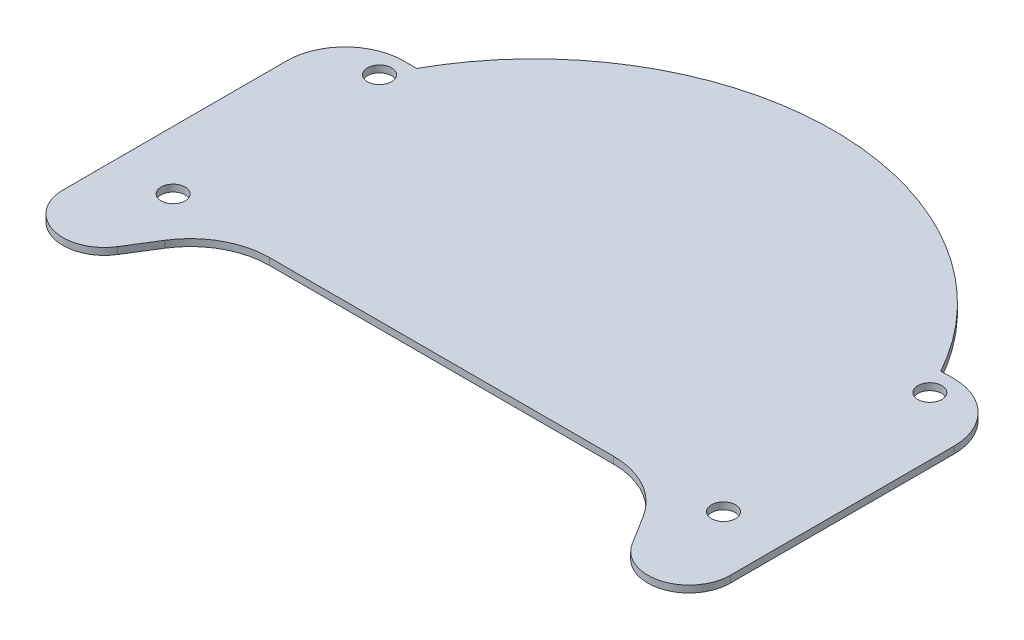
SolidWorks part; units mm, degrees
ref_plane "Alzado" through (0, 0, 0) normal (0, 0, 1) x (1, 0, 0)
ref_plane "Planta" through (0, 0, 0) normal (0, 1, 0) x (1, 0, 0)
ref_plane "Vista lateral" through (0, 0, 0) normal (1, 0, 0) x (0, 0, -1)
sketch "Croquis1" plane through (0, 0, 0) normal (0, 1, 0) x (1, 0, 0)
  line L6 (0, -7.8694) -> (0, 23.217) construction
  line L7 (50, 0) -> (-50, 0)
  line L8 (-66.9811, -9.434) -> (-72.2642, -17.9245)
  line L9 (80, 75) -> (77.9423, 75)
  line L10 (-100, -10) -> (-100, 55)
  line L11 (-80, 75) -> (-77.9423, 75)
  line L12 (100, -10) -> (100, 55)
  line L13 (66.9811, -9.434) -> (72.2642, -17.9245)
  arc A0 (-77.9423, 75) -> (77.9423, 75) centre (0, 30) cw
  arc A1 (-50, 0) -> (-66.9811, -9.434) centre (-50, -20) ccw
  arc A2 (-100, 55) -> (-80, 75) centre (-80, 55) cw
  arc A3 (-72.2642, -17.9245) -> (-100, -10) centre (-85, -10) cw
  arc A4 (72.2642, -17.9245) -> (100, -10) centre (85, -10) ccw
  arc A5 (100, 55) -> (80, 75) centre (80, 55) ccw
  arc A6 (50, 0) -> (66.9811, -9.434) centre (50, -20) cw
  circle A7 centre (-80, 65) radius 2.5
  circle A8 centre (-80, 5) radius 2.5
  circle A9 centre (80, 5) radius 2.5
  circle A10 centre (80, 65) radius 2.5
  point P0 (100, 75)
  point P11 (0, 0)
  point P15 (-100, 75)
sketch "Croquis2" plane through (0, 0, 0) normal (0, 1, 0) x (1, 0, 0)
  line L0 (66.9811, -9.434) -> (72.2642, -17.9245) construction
  line L1 (100, -10) -> (100, 55) construction
  line L2 (80, 75) -> (77.9423, 75) construction
  line L3 (50, 0) -> (-50, 0) construction
  line L4 (-66.9811, -9.434) -> (-72.2642, -17.9245) construction
  line L5 (-100, -10) -> (-100, 55) construction
  line L6 (-80, 75) -> (-77.9423, 75) construction
  line L7 (66.9811, -9.434) -> (72.2642, -17.9245)
  line L8 (100, -10) -> (100, 55)
  line L9 (80, 75) -> (77.9423, 75)
  line L10 (50, 0) -> (-50, 0)
  line L11 (-66.9811, -9.434) -> (-72.2642, -17.9245)
  line L12 (-100, -10) -> (-100, 55)
  line L13 (-80, 75) -> (-77.9423, 75)
  line L14 (0, -200007.8694) -> (0, 200023.217) construction
  line L15 (-48.6068, 49.4273) -> (-27.6068, 49.4273)
  line L16 (-48.6068, 49.4273) -> (-48.6068, 65.4273)
  line L17 (-48.6068, 65.4273) -> (-27.6068, 65.4273)
  line L18 (-27.6068, 49.4273) -> (-27.6068, 65.4273)
  line L19 (-48.6068, 49.4273) -> (-27.6068, 65.4273) construction
  line L20 (-48.6068, 65.4273) -> (-27.6068, 49.4273) construction
  line L21 (0, -200007.8694) -> (0, 200023.217) construction
  line L22 (-28, 105.9273) -> (28, 105.9273)
  line L23 (-28, 105.9273) -> (-28, 70.9273)
  line L24 (-28, 70.9273) -> (28, 70.9273)
  line L25 (28, 105.9273) -> (28, 70.9273)
  line L26 (-28, 105.9273) -> (28, 70.9273) construction
  line L27 (-28, 70.9273) -> (28, 105.9273) construction
  line L28 (0, 0) -> (0, 120) construction
  line L30 (-80.2642, 30.8767) -> (-64.2642, 30.8767)
  line L31 (-80.2642, 30.8767) -> (-80.2642, 48.8767)
  line L32 (-80.2642, 48.8767) -> (-64.2642, 48.8767)
  line L33 (-64.2642, 30.8767) -> (-64.2642, 48.8767)
  line L34 (-80.2642, 30.8767) -> (-64.2642, 48.8767) construction
  line L35 (-80.2642, 48.8767) -> (-64.2642, 30.8767) construction
  line L36 (-85.2642, 35.3767) -> (-80.2642, 35.3767)
  line L37 (-85.2642, 35.3767) -> (-85.2642, 44.3767)
  line L38 (-85.2642, 44.3767) -> (-80.2642, 44.3767)
  line L39 (-80.2642, 35.3767) -> (-80.2642, 44.3767)
  line L40 (-85.2642, 35.3767) -> (-80.2642, 44.3767) construction
  line L41 (-85.2642, 44.3767) -> (-80.2642, 35.3767) construction
  line L42 (-14.5, 57.4273) -> (14.5, 57.4273)
  line L43 (-14.5, 57.4273) -> (-14.5, 1.4273)
  line L44 (-14.5, 1.4273) -> (14.5, 1.4273)
  line L45 (14.5, 57.4273) -> (14.5, 1.4273)
  line L46 (-14.5, 57.4273) -> (14.5, 1.4273) construction
  line L47 (-14.5, 1.4273) -> (14.5, 57.4273) construction
  line L48 (57.5127, 31.7346) -> (69.5127, 31.7346)
  line L49 (57.5127, 31.7346) -> (57.5127, 19.7346)
  line L50 (57.5127, 19.7346) -> (69.5127, 19.7346)
  line L51 (69.5127, 31.7346) -> (69.5127, 19.7346)
  line L52 (57.5127, 31.7346) -> (69.5127, 19.7346) construction
  line L53 (57.5127, 19.7346) -> (69.5127, 31.7346) construction
  line L57 (43.3706, 45.8767) -> (43.3706, 33.8767)
  line L58 (43.3706, 45.8767) -> (55.3706, 45.8767)
  line L59 (55.3706, 45.8767) -> (55.3706, 33.8767)
  line L60 (43.3706, 33.8767) -> (55.3706, 33.8767)
  line L61 (57.5127, 60.0188) -> (57.5127, 48.0188)
  line L62 (57.5127, 60.0188) -> (69.5127, 60.0188)
  line L63 (69.5127, 60.0188) -> (69.5127, 48.0188)
  line L64 (57.5127, 48.0188) -> (69.5127, 48.0188)
  line L65 (71.6548, 45.8767) -> (71.6548, 33.8767)
  line L66 (71.6548, 45.8767) -> (83.6548, 45.8767)
  line L67 (83.6548, 45.8767) -> (83.6548, 33.8767)
  line L68 (71.6548, 33.8767) -> (83.6548, 33.8767)
  line L70 (-64.46, 18.7513) -> (-56.46, 18.7513)
  line L71 (-64.46, 18.7513) -> (-64.46, 10.7513)
  line L72 (-64.46, 10.7513) -> (-56.46, 10.7513)
  line L73 (-56.46, 18.7513) -> (-56.46, 10.7513)
  line L74 (-64.46, 18.7513) -> (-56.46, 10.7513) construction
  line L75 (-64.46, 10.7513) -> (-56.46, 18.7513) construction
  line L80 (-9, 64.4273) -> (9, 64.4273)
  line L81 (-9, 64.4273) -> (-9, 57.4273)
  line L82 (-98.9874, 0.7513) -> (-81.9874, 0.7513)
  line L83 (-98.9874, 0.7513) -> (-98.9874, -12.2487)
  line L84 (-98.9874, -12.2487) -> (-81.9874, -12.2487)
  line L85 (-81.9874, 0.7513) -> (-81.9874, -12.2487)
  line L86 (-98.9874, 0.7513) -> (-81.9874, -12.2487) construction
  line L87 (-98.9874, -12.2487) -> (-81.9874, 0.7513) construction
  line L88 (-92.9874, -10.2487) -> (-99.9874, -10.2487)
  line L89 (-92.9874, -10.2487) -> (-92.9874, -1.2487)
  line L90 (-92.9874, -1.2487) -> (-99.9874, -1.2487)
  line L91 (-99.9874, -10.2487) -> (-99.9874, -1.2487)
  line L92 (-92.9874, -10.2487) -> (-99.9874, -1.2487) construction
  line L93 (-92.9874, -1.2487) -> (-99.9874, -10.2487) construction
  line L94 (-9, 57.4273) -> (9, 57.4273)
  line L95 (9, 64.4273) -> (9, 57.4273)
  line L96 (-9, 64.4273) -> (9, 57.4273) construction
  line L97 (-9, 57.4273) -> (9, 64.4273) construction
  line L98 (27.8448, 19.3621) -> (38.0048, 19.3621)
  line L99 (27.8448, 19.3621) -> (27.8448, 6.6621)
  line L100 (27.8448, 6.6621) -> (38.0048, 6.6621)
  line L101 (38.0048, 19.3621) -> (38.0048, 6.6621)
  line L102 (27.8448, 19.3621) -> (38.0048, 6.6621) construction
  line L103 (27.8448, 6.6621) -> (38.0048, 19.3621) construction
  arc A0 (72.2642, -17.9245) -> (100, -10) centre (85, -10) ccw construction
  arc A1 (100, 55) -> (80, 75) centre (80, 55) ccw construction
  arc A2 (77.9423, 75) -> (-77.9423, 75) centre (0, 30) ccw construction
  arc A3 (-50, 0) -> (-66.9811, -9.434) centre (-50, -20) ccw construction
  arc A4 (-100, -10) -> (-72.2642, -17.9245) centre (-85, -10) ccw construction
  arc A5 (-80, 75) -> (-100, 55) centre (-80, 55) ccw construction
  arc A6 (72.2642, -17.9245) -> (100, -10) centre (85, -10) ccw
  arc A7 (100, 55) -> (80, 75) centre (80, 55) ccw
  arc A8 (77.9423, 75) -> (-77.9423, 75) centre (0, 30) ccw
  arc A9 (-50, 0) -> (-66.9811, -9.434) centre (-50, -20) ccw
  arc A10 (-100, -10) -> (-72.2642, -17.9245) centre (-85, -10) ccw
  arc A11 (-80, 75) -> (-100, 55) centre (-80, 55) ccw
  arc A12 (66.9811, -9.434) -> (50, 0) centre (50, -20) ccw construction
  arc A13 (66.9811, -9.434) -> (50, 0) centre (50, -20) ccw
  circle A14 centre (25.5, 103.4273) radius 1.25
  circle A15 centre (25.5, 73.4273) radius 1.25
  circle A16 centre (-25.5, 73.4273) radius 1.25
  circle A17 centre (-25.5, 103.4273) radius 1.25
  circle A18 centre (-47.8414, 30.2356) radius 2.5
  circle A22 centre (-41.1978, 22.7615) radius 2.5
  circle A23 centre (-34.5541, 30.2356) radius 2.5
  circle A24 centre (-41.1978, 37.7097) radius 2.5
  text T0 "ESP32-S3"
  text T1 "ADXL345  " font "Century Gothic" height in points 10
  text T2 "SWITCH  BUTTON" font "Century Gothic" height in points 9
  text T3 "LEDS  "
  text T4 "JOYSTICK"
  text T5 "  TFT  DISPLAY"
  text T6 "  Push  Buttons" font "Century Gothic" height in points 9
  text T7 "hw-373"
  point P21 (-38.1068, 57.4273)
  point P29 (0, 88.4273)
  point P44 (-72.2642, 39.8767)
  point P49 (-82.7642, 39.8767)
  point P54 (0, 29.4273)
  point P62 (-60.46, 14.7513)
  point P63 (63.5127, 25.7346)
  point P81 (43.3706, 39.8767)
  point P98 (-90.4874, -5.7487)
  point P107 (-96.4874, -5.7487)
  point P117 (32.9248, 13.0121)
  point P119 (0, 60.9273)
  dimension "D7" = 2.5
  dimension "D18" = 5
  dimension "D1" = 16
  dimension "D2" = 21
  dimension "D3" = 56
  dimension "D4" = 35
  dimension "D5" = 30
  dimension "D6" = 15
  dimension "D8" = 25.5
  dimension "D9" = 18
  dimension "D10" = 16
  dimension "D11" = 21
  dimension "D12" = 9
  dimension "D13" = 29
  dimension "D14" = 56
  dimension "D15" = 12
  dimension "D20" = 8
  dimension "D21" = 18
  dimension "D22" = 7
  dimension "D23" = 17
  dimension "D24" = 13
  dimension "D25" = 9
  dimension "D26" = 7
  dimension "D27" = 1
  dimension "D28" = 2
  dimension "D29" = 12.7
  dimension "D30" = 10.16
  dimension "D16" = 2
  dimension "D17" = 2
  dimension "D19" = 2
sketch "Croquis9" plane through (0, 0, 0) normal (0, 1, 0) x (1, 0, 0)
  line L0 (80, 75) -> (77.9423, 75) construction
  line L1 (100, -10) -> (100, 55) construction
  line L2 (66.9811, -9.434) -> (72.2642, -17.9245) construction
  line L3 (50, 0) -> (-50, 0) construction
  line L4 (-66.9811, -9.434) -> (-72.2642, -17.9245) construction
  line L5 (-100, -10) -> (-100, 55) construction
  line L6 (-80, 75) -> (-77.9423, 75) construction
  line L7 (80, 75) -> (77.9423, 75) construction
  line L8 (100, -10) -> (100, 55) construction
  line L9 (66.9811, -9.434) -> (72.2642, -17.9245) construction
  line L10 (50, 0) -> (-50, 0) construction
  line L11 (-66.9811, -9.434) -> (-72.2642, -17.9245) construction
  line L12 (-100, -10) -> (-100, 55) construction
  line L13 (-80, 75) -> (-77.9423, 75) construction
  line L14 (80, 72) -> (76.1906, 72)
  line L15 (-80, 72) -> (-76.1906, 72)
  line L16 (-97, -10) -> (-97, 55)
  line L17 (-69.5283, -7.8491) -> (-74.8113, -16.3396)
  line L18 (50, 3) -> (-50, 3)
  line L19 (69.5283, -7.8491) -> (74.8113, -16.3396)
  line L20 (97, -10) -> (97, 55)
  arc A0 (77.9423, 75) -> (-77.9423, 75) centre (0, 30) ccw construction
  arc A1 (77.9423, 75) -> (-77.9423, 75) centre (0, 30) ccw construction
  arc A2 (100, 55) -> (80, 75) centre (80, 55) ccw construction
  arc A3 (72.2642, -17.9245) -> (100, -10) centre (85, -10) ccw construction
  arc A4 (66.9811, -9.434) -> (50, 0) centre (50, -20) ccw construction
  arc A5 (-50, 0) -> (-66.9811, -9.434) centre (-50, -20) ccw construction
  arc A6 (-100, -10) -> (-72.2642, -17.9245) centre (-85, -10) ccw construction
  arc A7 (-80, 75) -> (-100, 55) centre (-80, 55) ccw construction
  arc A8 (100, 55) -> (80, 75) centre (80, 55) ccw construction
  arc A9 (72.2642, -17.9245) -> (100, -10) centre (85, -10) ccw construction
  arc A10 (66.9811, -9.434) -> (50, 0) centre (50, -20) ccw construction
  arc A11 (-50, 0) -> (-66.9811, -9.434) centre (-50, -20) ccw construction
  arc A12 (-100, -10) -> (-72.2642, -17.9245) centre (-85, -10) ccw construction
  arc A13 (-80, 75) -> (-100, 55) centre (-80, 55) ccw construction
  arc A14 (76.1906, 72) -> (-76.1906, 72) centre (0, 30) ccw
  arc A15 (-80, 72) -> (-97, 55) centre (-80, 55) ccw
  arc A16 (-97, -10) -> (-74.8113, -16.3396) centre (-85, -10) ccw
  arc A17 (-50, 3) -> (-69.5283, -7.8491) centre (-50, -20) ccw
  arc A18 (69.5283, -7.8491) -> (50, 3) centre (50, -20) ccw
  arc A19 (74.8113, -16.3396) -> (97, -10) centre (85, -10) ccw
  arc A20 (97, 55) -> (80, 72) centre (80, 55) ccw
  circle A21 centre (80, 5) radius 2.5 construction
  circle A22 centre (80, 65) radius 2.5 construction
  circle A23 centre (-80, 5) radius 2.5 construction
  circle A24 centre (-80, 65) radius 2.5 construction
  circle A25 centre (80, 5) radius 2.5 construction
  circle A26 centre (80, 65) radius 2.5 construction
  circle A27 centre (-80, 5) radius 2.5 construction
  circle A28 centre (-80, 65) radius 2.5 construction
  circle A29 centre (-80, 65) radius 3.5
  circle A30 centre (80, 65) radius 3.5
  circle A31 centre (80, 5) radius 3.5
  circle A32 centre (-80, 5) radius 3.5
  dimension "D1" = 3
  dimension "D2" = 1
extrude "Saliente-Extruir1" add sketch "Croquis9" along normal blind 2
sketch "Croquis4" plane through (0, 3, 0) normal (0, -1, 0) x (1, 0, 0)
  line L0 (-105, 10) -> (-105, -55) construction
  line L1 (105, 10) -> (105, -55) construction
  line L2 (62.7358, 12.0755) -> (68.0189, 20.566) construction
  line L3 (50, 5) -> (-50, 5) construction
  line L4 (-62.7358, 12.0755) -> (-68.0189, 20.566) construction
  line L5 (-105, 10) -> (-105, -55)
  line L6 (105, 10) -> (105, -55)
  line L7 (62.7358, 12.0755) -> (68.0189, 20.566)
  line L8 (50, 5) -> (-50, 5)
  line L9 (-62.7358, 12.0755) -> (-68.0189, 20.566)
  arc A0 (-105, -55) -> (-80.7851, -79.9877) centre (-80, -55) ccw construction
  arc A1 (-80.7851, -79.9877) -> (80.7851, -79.9877) centre (0, -30) ccw construction
  arc A2 (80.7851, -79.9877) -> (105, -55) centre (80, -55) ccw construction
  arc A3 (105, 10) -> (68.0189, 20.566) centre (85, 10) ccw construction
  arc A4 (50, 5) -> (62.7358, 12.0755) centre (50, 20) ccw construction
  arc A5 (-62.7358, 12.0755) -> (-50, 5) centre (-50, 20) ccw construction
  arc A6 (-68.0189, 20.566) -> (-105, 10) centre (-85, 10) ccw construction
  arc A7 (-105, -55) -> (-80.7851, -79.9877) centre (-80, -55) ccw
  arc A8 (-80.7851, -79.9877) -> (80.7851, -79.9877) centre (0, -30) ccw
  arc A9 (80.7851, -79.9877) -> (105, -55) centre (80, -55) ccw
  arc A10 (105, 10) -> (68.0189, 20.566) centre (85, 10) ccw
  arc A11 (50, 5) -> (62.7358, 12.0755) centre (50, 20) ccw
  arc A12 (-62.7358, 12.0755) -> (-50, 5) centre (-50, 20) ccw
  arc A13 (-68.0189, 20.566) -> (-105, 10) centre (-85, 10) ccw
sketch "Croquis8" plane through (0, 18, 0) normal (0, 1, 0) x (1, 0, 0)
  line L1 (-19, -5) -> (19, -5)
  line L2 (-19, -5) -> (-19, 5)
  line L3 (-19, 5) -> (19, 5)
  line L4 (19, -5) -> (19, 5)
  line L5 (-19, -5) -> (19, 5) construction
  line L6 (-19, 5) -> (19, -5) construction
  point P0 (0, 0)
  dimension "D1" = 38
  dimension "D2" = 10
equation "\"alto\"= 85"
equation "\"ancho\"= 200"
equation "\"radio_cupula\"= 90"
equation "\"redondeos\"= 20"
equation "\"radio_mangos\"= 15"
equation "\"D2@Croquis1\"=\"ancho\""
equation "\"D8@Croquis1\"=\"redondeos\""
equation "\"D6@Croquis1\"=\"radio_mangos\""
equation "\"D4@Croquis1\"=\"radio_cupula\""
equation "\"D7@Croquis1\"=\"radio_cupula\"/2"
